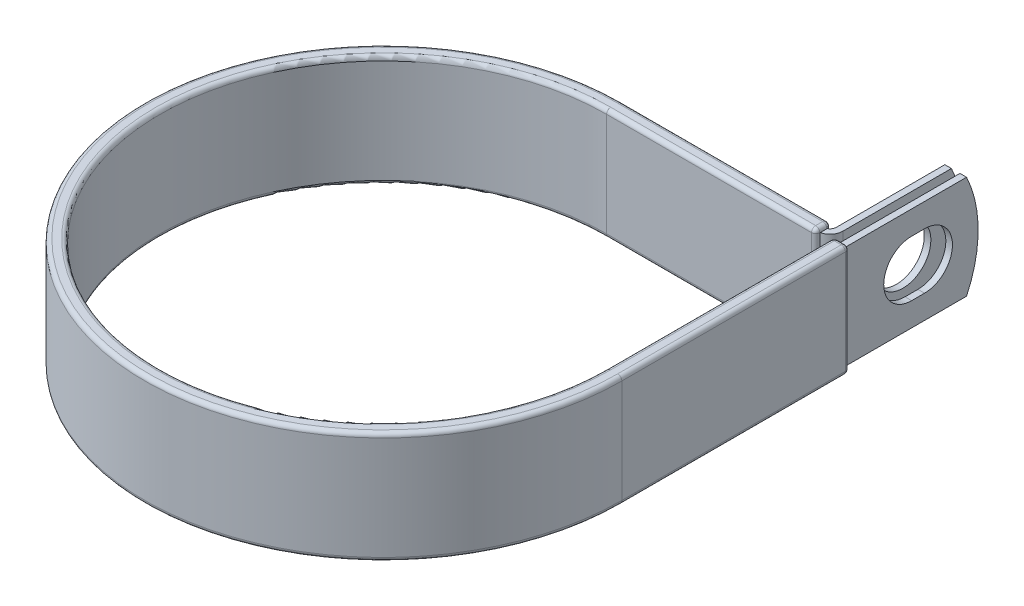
SolidWorks part; units mm, degrees
ref_plane "Front Plane" through (0, 0, 0) normal (0, 0, 1) x (1, 0, 0)
ref_plane "Top Plane" through (0, 0, 0) normal (0, 1, 0) x (1, 0, 0)
ref_plane "Right Plane" through (0, 0, 0) normal (1, 0, 0) x (0, 0, -1)
sketch "Sketch1" plane through (0, 0, 0) normal (0, 1, 0) x (1, 0, 0)
  line L0 (0, 42.0688) -> (38.1165, 42.0688)
  line L1 (42.0688, 0) -> (42.0688, 42.0688)
  line L2 (40.4939, 66.6496) -> (40.4939, 44.4462)
  line L5 (42.0688, 42.0688) -> (42.0688, 66.6496)
  arc A0 (0, 42.0688) -> (42.0688, 0) centre (0, 0) ccw
  arc A3 (38.1165, 42.0688) -> (40.4939, 44.4462) centre (38.1165, 44.4462) ccw
extrude "Extrude-Thin1" add sketch "Sketch1" along normal mid plane 19.05 thin
sketch "Sketch2" plane through (39.2747, 0, 0) normal (-1, 0, 0) x (0, 0, 1)
  line L0 (-66.6496, 9.525) -> (-66.6496, -9.525) construction
  line L7 (0, 9.525) -> (0, -9.525) construction
  circle A0 centre (-55.5498, 0) radius 5.1562
  point P2 (-66.6496, 0)
extrude "Cut-Extrude1" cut sketch "Sketch2" against normal up to surface (1.2192 mm away)
sketch "Sketch3" plane through (43.288, 0, 0) normal (1, 0, 0) x (0, 0, -1)
  line L0 (54.356, 0) -> (56.7436, 0) construction
  line L1 (54.356, 5.1562) -> (56.7436, 5.1562)
  line L2 (54.356, -5.1562) -> (56.7436, -5.1562)
  line L3 (66.6496, 9.525) -> (66.6496, -9.525) construction
  arc A0 (54.356, 5.1562) -> (54.356, -5.1562) centre (54.356, 0) ccw
  arc A1 (56.7436, -5.1562) -> (56.7436, 5.1562) centre (56.7436, 0) ccw
  point P3 (55.5498, 0)
  point P8 (66.6496, 0)
  point P11 (49.1998, 0)
  point P12 (61.8998, 0)
extrude "Cut-Extrude2" cut sketch "Sketch3" against normal up to surface (1.2192 mm away)
sketch "Sketch4" plane through (39.2747, 0, 0) normal (-1, 0, 0) x (0, 0, 1)
  line L0 (-66.6496, 9.525) -> (-66.6496, -9.525)
  line L1 (-66.6496, 9.525) -> (-64.5051, 9.525)
  line L2 (-66.6496, 9.525) -> (-44.4462, 9.525) construction
  line L3 (-66.6496, -9.525) -> (-64.5051, -9.525)
  line L4 (-66.6496, -9.525) -> (-44.4462, -9.525) construction
  arc A0 (-64.5051, 9.525) -> (-64.5051, -9.525) centre (-44.4246, 0) ccw
extrude "Cut-Extrude3" cut sketch "Sketch4" against normal through all contours A0 M4 M5 | A0 L0 M2
ref_plane "Plane1" through (0, 0, -42.0688) normal (0, 0, 1) x (1, 0, 0)
ref_plane "Plane2" through (0, 0, 0) normal (-1, 0, 0) x (0, 0, 1)
sketch "Sketch5" plane through (0, 0, -42.0688) normal (0, 0, 1) x (1, 0, 0)
  line L0 (42.0688, 9.525) -> (43.288, 9.525)
  line L1 (42.0688, -9.525) -> (42.0688, 9.525)
  line L2 (41.275, -9.5567) -> (41.275, 9.5567)
  line L3 (43.288, 9.525) -> (43.288, -9.525)
  line L4 (43.288, -9.525) -> (42.0688, -9.525)
  line L5 (42.037, 10.3187) -> (43.3197, 10.3188)
  line L7 (44.0817, 9.5567) -> (44.0817, -9.5567)
  line L8 (43.3197, -10.3188) -> (42.037, -10.3188)
  line L9 (41.275, -10.3188) -> (41.275, 10.3187) construction
  line L11 (44.0817, -10.3188) -> (41.275, -10.3188) construction
  line L12 (44.0817, 10.3187) -> (44.0817, -10.3188) construction
  line L13 (41.275, 10.3187) -> (44.0817, 10.3187) construction
  arc A0 (41.275, -9.5567) -> (42.037, -10.3188) centre (42.037, -9.5567) ccw
  arc A1 (44.0817, -9.5567) -> (43.3197, -10.3188) centre (43.3197, -9.5567) cw
  arc A2 (41.275, 9.5567) -> (42.037, 10.3187) centre (42.037, 9.5567) cw
  arc A3 (43.3197, 10.3188) -> (44.0817, 9.5567) centre (43.3197, 9.5567) cw
sketch "Sketch6" plane through (0, 9.525, 0) normal (0, 1, 0) x (1, 0, 0)
  line L0 (41.275, 0) -> (41.275, 42.0688)
  line L1 (0, 41.275) -> (38.6398, 41.275)
  line L2 (39.2748, 64.5051) -> (39.2748, 44.4462) construction
  arc A0 (0, 41.275) -> (41.275, 0) centre (0, 0) ccw
sweep "Sweep1" add profiles "Sketch5" path "Sketch6"
fillet "Fillet1" radius 0.762 16 edges at (38.6398, 10.0956, -43.8585) (38.6398, 0, -44.0817) (38.6398, -10.0956, -43.8585) (38.6398, -10.3188, -42.6784) (38.6398, -10.0956, -41.4982) (38.6398, 0, -41.275) (38.6398, 10.0956, -41.4982) (43.8585, 10.0956, -42.0688) (44.0817, 0, -42.0688) (43.8585, -10.0956, -42.0688) (42.6784, -10.3188, -42.0688) (41.4982, -10.0956, -42.0688) (41.275, 0, -42.0688) (41.4982, 10.0956, -42.0688) (38.6398, 10.3187, -42.6784) (42.6784, 10.3187, -42.0688)
equation "\"D4@Sketch5\" = \"D1@Extrude-Thin1\""
equation "\"D5@Sketch5\" = \"D5@Extrude-Thin1\""
equation "\"D1@Sketch3\" = \"D2@Sketch2\""
equation "\"D7@Sketch1\" = \"D3@Sketch2\" + \"D1@Sketch3\""
equation "\"D1@Sketch1\" = \"D1@Sketch6\" + 2 * \"D3@Sketch5\""
equation "\"D1@Sketch4\" = ( \"D1@Extrude-Thin1\" + .125 ) * 2"
equation "\"D2@Sketch1\"=1.95*\"D5@Extrude-Thin1\""
equation "\"D2@Sketch3\" = \"D1@Sketch2\""
